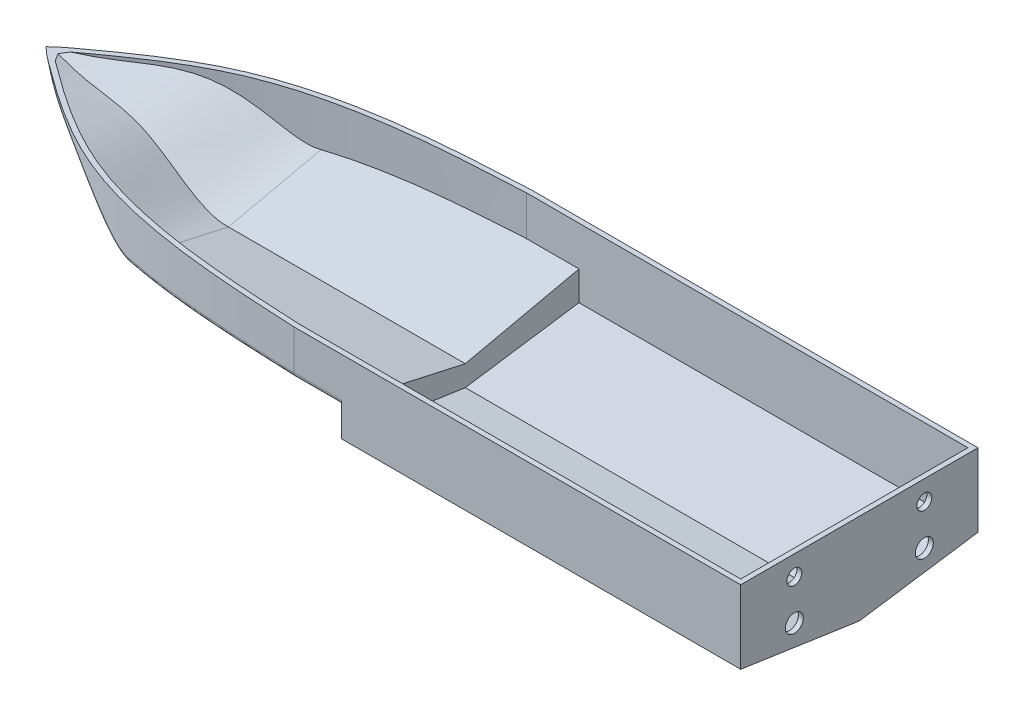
SolidWorks part; units mm, degrees
ref_plane "Plan de face" through (0, 0, 0) normal (0, 0, 1) x (1, 0, 0)
ref_plane "Plan de dessus" through (0, 0, 0) normal (0, 1, 0) x (1, 0, 0)
ref_plane "Plan de droite" through (0, 0, 0) normal (1, 0, 0) x (0, 0, -1)
sketch "Esquisse1" plane through (0, 0, 0) normal (0, 1, 0) x (1, 0, 0)
  line L0 (0, -23.7898) -> (0, 23.7898)
  line L1 (0, 0) -> (-163.4072, 0) construction
  line L2 (0, 23.7898) -> (-89.5618, 23.7898)
  line L3 (0, -23.7898) -> (-89.5618, -23.7898)
  spline S0 degree 3 poles (-89.5618, -23.7898) (-98.8346, -23.3271) (-115.8402, -22.4785) (-141.966, -16.053) (-155.8211, -5.6797) (-163.4072, 0) knots 0 0 0 0 0.351731 0.64505 1 1 1 1
  spline S1 degree 3 poles (-89.5618, 23.7898) (-98.8346, 23.3271) (-115.8402, 22.4785) (-141.966, 16.053) (-155.8211, 5.6797) (-163.4072, 0) knots 0 0 0 0 0.351731 0.64505 1 1 1 1
extrude "Extrusion1" add sketch "Esquisse1" against normal blind 20
sketch "Esquisse2" plane through (0, 0, 0) normal (1, 0, 0) x (0, 0, -1)
  line L0 (-23.7898, -14.6816) -> (0, -18.1845)
  line L1 (-23.7898, -20) -> (-23.7898, 0) construction
  line L2 (-23.7898, -20) -> (23.7898, -20)
  line L3 (23.7898, -20) -> (23.7898, 0) construction
  line L4 (23.7898, -20) -> (23.7898, -14.6816)
  line L5 (23.7898, -14.6816) -> (0, -18.1845)
  line L6 (-23.7898, -20) -> (23.7898, -20) construction
  line L7 (-23.7898, -20) -> (-23.7898, -14.6816)
  line L8 (-23.7898, -20) -> (-23.7898, 0) construction
  line L9 (0, -18.1845) -> (0, -20) construction
extrude "Extrusion2" cut sketch "Esquisse2" against normal blind 80
sketch "Esquisse3" plane through (-80, 0, 0) normal (1, 0, 0) x (0, 0, -1)
  line L0 (-23.7898, -8.7565) -> (0, -14.0369)
  line L1 (-23.7898, -14.6816) -> (-23.7898, -20) construction
  line L2 (0, -14.0369) -> (23.7898, -8.7565)
  line L3 (23.7898, -20) -> (23.7898, -14.6816) construction
  line L4 (23.7898, -20) -> (23.7898, -8.7565)
  line L5 (23.7898, -20) -> (-23.7898, -20)
  line L6 (-23.7898, -20) -> (-23.7898, -8.7565)
sketch "Esquisse4" plane through (0, 0, 0) normal (0, 0, 1) x (1, 0, 0)
  line L0 (-80, -14.0369) -> (-126.4896, -14.0369)
  spline S0 degree 3 poles (-126.4896, -14.0369) (-126.8119, -14.0369) (-133.2572, -14.0369) (-141.9552, -3.7471) (-155.1364, -3.3615) (-161.1454, -0.9193) (-163.4072, 0) knots 0 0 0 0 0.025612 0.512246 0.816407 1 1 1 1
sweep "Enlèvement de matière-Balayage2" cut profiles "Esquisse3" path "Esquisse4"
fillet "Congé1" radius 1 4 edges at (-135.0467, -6.5193, -17.0652) (-134.0471, -7.1122, 17.4181)
fillet "Congé2" radius 1 4 edges at (-89.5618, -3.9769, -23.7898) (-89.5618, -3.9769, 23.7898) (-88.9084, -8.1998, -23.7898) (-89.5135, -8.0226, 23.7898)
scale "Echelle1" scale about centroid uniform scaling yes scale factor 50
shell "Coque1" thickness 50
sketch "Esquisse5" plane through (3055.9279, 0, 0) normal (1, 0, 0) x (0, 0, -1)
  line L0 (1189.4868, -372.3579) -> (1189.4868, 361.724) construction
  line L2 (-1189.4981, 361.724) -> (1189.4868, 361.724) construction
  circle A0 centre (-651.6482, 161.724) radius 75
  circle A1 centre (651.6418, 161.724) radius 75
  dimension "D1" = 1303.29
  dimension "D2" = 150
  dimension "D3" = 150
  dimension "D4" = 537.845
  dimension "D5" = 200
  dimension "D6" = 200
extrude "Extrusion3" cut sketch "Esquisse5" against normal blind 960
sketch "Esquisse6" plane through (3055.9279, 0, 0) normal (1, 0, 0) x (0, 0, -1)
  line L0 (-1189.4981, -372.3579) -> (-1189.4981, 361.724) construction
  line L1 (1189.4868, -372.3579) -> (1189.4868, 361.724) construction
  circle A0 centre (-651.6481, -239.966) radius 90
  circle A1 centre (651.6368, -239.966) radius 90
  circle A2 centre (-651.6482, 161.724) radius 75 construction
  circle A3 centre (651.6418, 161.724) radius 75 construction
  dimension "D1" = 401.69
  dimension "D2" = 401.69
  dimension "D3" = 537.85
  dimension "D4" = 537.85
  dimension "D5" = 180
  dimension "D6" = 180
extrude "Extrusion4" cut sketch "Esquisse6" against normal blind 960
